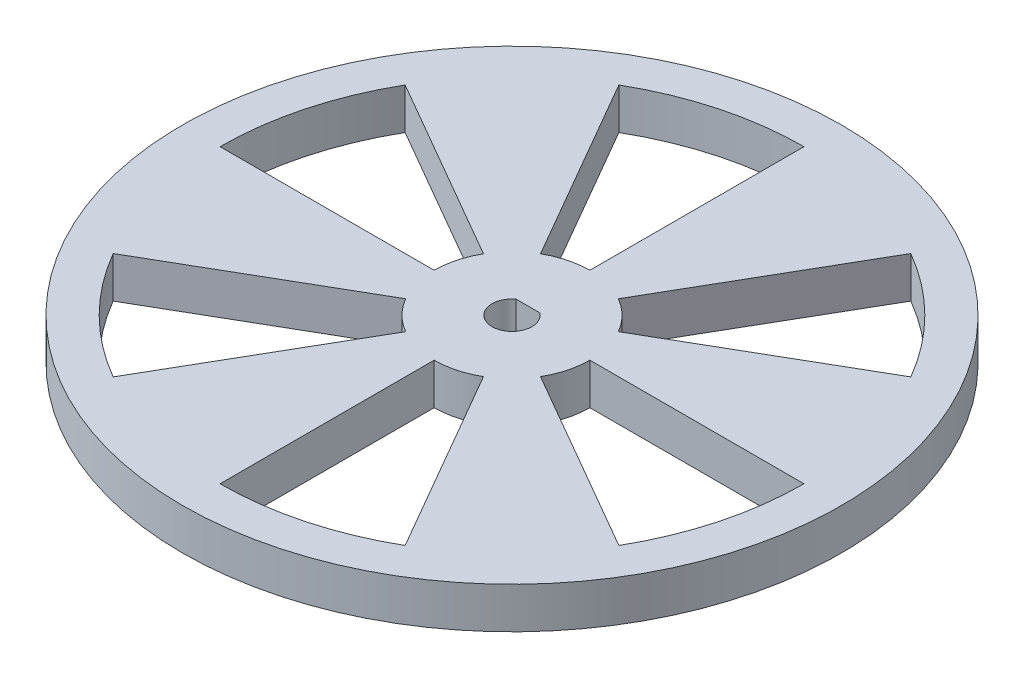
SolidWorks part; units mm, degrees
ref_plane "Front Plane" through (0, 0, 0) normal (0, 0, 1) x (1, 0, 0)
ref_plane "Top Plane" through (0, 0, 0) normal (0, 1, 0) x (1, 0, 0)
ref_plane "Right Plane" through (0, 0, 0) normal (1, 0, 0) x (0, 0, -1)
sketch "Sketch1" plane through (0, 0, 0) normal (0, 1, 0) x (1, 0, 0)
  line L0 (0, -12) -> (0, -45)
  line L1 (-6, 10.3923) -> (-22.5, 38.9711)
  line L2 (-10.3923, 6) -> (-38.9711, 22.5)
  line L3 (-12, 0) -> (-45, 0)
  line L4 (1.8319, 2.4636) -> (-1.8319, 2.4636)
  line L5 (10.3923, 6) -> (38.9711, 22.5)
  line L6 (6, 10.3923) -> (22.5, 38.9711)
  line L7 (0, 12) -> (0, 45)
  line L8 (6, -10.3923) -> (22.5, -38.9711)
  line L9 (10.3923, -6) -> (38.9711, -22.5)
  line L10 (12, 0) -> (45, 0)
  line L11 (-10.3923, -6) -> (-38.9711, -22.5)
  line L12 (-6, -10.3923) -> (-22.5, -38.9711)
  arc A0 (10.3923, -6) -> (12, 0) centre (0, 0) ccw
  arc A1 (-1.8319, 2.4636) -> (1.8319, 2.4636) centre (0, 0) ccw
  circle A2 centre (0, 0) radius 50.8
  arc A3 (0, -45) -> (22.5, -38.9711) centre (0, 0) ccw
  arc A4 (38.9711, -22.5) -> (45, 0) centre (0, 0) ccw
  arc A5 (38.9711, 22.5) -> (22.5, 38.9711) centre (0, 0) ccw
  arc A6 (0, -12) -> (6, -10.3923) centre (0, 0) ccw
  arc A7 (-10.3923, -6) -> (-6, -10.3923) centre (0, 0) ccw
  arc A8 (-38.9711, -22.5) -> (-22.5, -38.9711) centre (0, 0) ccw
  arc A9 (-10.3923, 6) -> (-12, 0) centre (0, 0) ccw
  arc A10 (-38.9711, 22.5) -> (-45, 0) centre (0, 0) ccw
  arc A11 (0, 45) -> (-22.5, 38.9711) centre (0, 0) ccw
  arc A12 (0, 12) -> (-6, 10.3923) centre (0, 0) ccw
  arc A13 (10.3923, 6) -> (6, 10.3923) centre (0, 0) ccw
  dimension "D1" = 2.4636
  dimension "D2" = 3.07
  dimension "D3" = 101.6
  dimension "D4" = 45
  dimension "D5" = 12
extrude "Extrude1" add sketch "Sketch1" along normal blind 6.35
